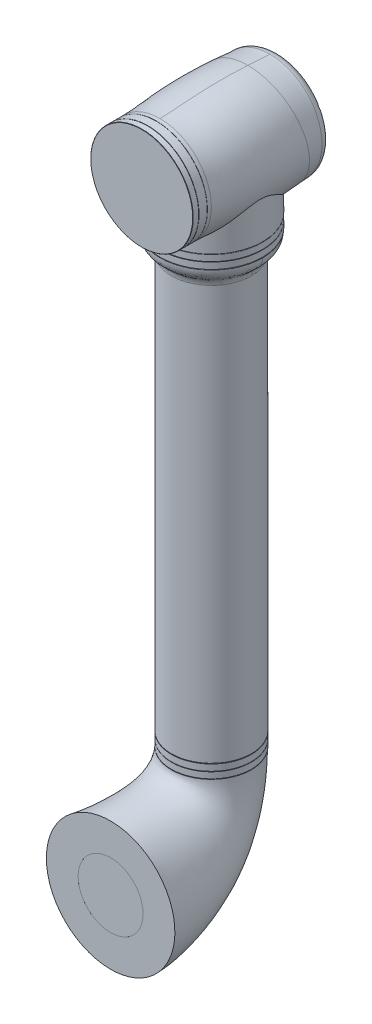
SolidWorks part; units mm, degrees
ref_plane "前视基准面" through (0, 0, 0) normal (0, 0, 1) x (1, 0, 0)
ref_plane "上视基准面" through (0, 0, 0) normal (0, 1, 0) x (1, 0, 0)
ref_plane "右视基准面" through (0, 0, 0) normal (1, 0, 0) x (0, 0, -1)
imported_body "输入1"
imported_body "输入2"
imported_body "输入3"
imported_body "输入4"
imported_body "输入5"
sketch "草图1" plane through (0, 0, -335.16) normal (0, 0, 1) x (1, 0, 0)
  circle A0 centre (0, 1015.5) radius 37.3724
extrude "切除-拉伸1" cut sketch "草图1" against normal blind 0.01
other "移动面1" parameters "D1"=0.01
